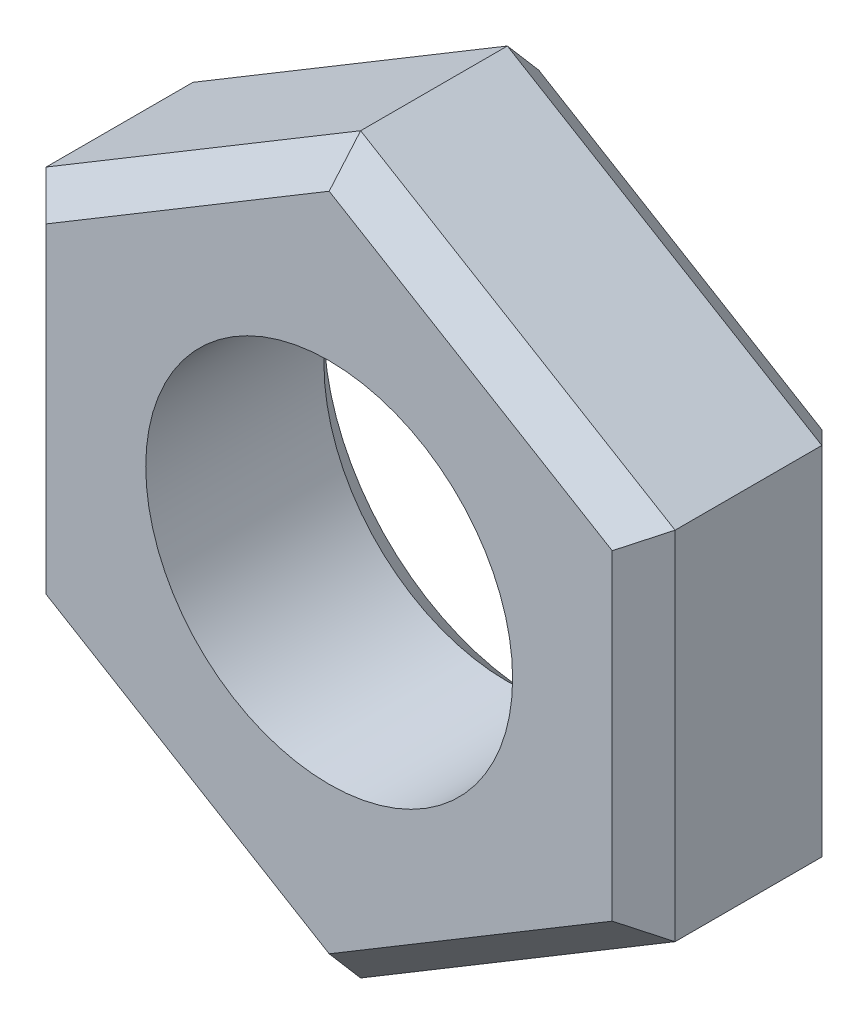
SolidWorks part; units mm, degrees
ref_plane "Plan de face" through (0, 0, 0) normal (0, 0, 1) x (1, 0, 0)
ref_plane "Plan de dessus" through (0, 0, 0) normal (0, 1, 0) x (1, 0, 0)
ref_plane "Plan de droite" through (0, 0, 0) normal (1, 0, 0) x (0, 0, -1)
sketch "Esquisse1" plane through (0, 0, 0) normal (0, 0, 1) x (1, 0, 0)
  line L0 (0, 17.5) -> (0, 0) construction
  line L1 (0, 0) -> (-15, 0) construction
  line L2 (-15, -8.5) -> (-15, 8.5)
  line L3 (-15, 8.5) -> (0, 17.5)
  line L4 (15, 8.5) -> (0, 17.5)
  line L5 (15, -8.5) -> (15, 8.5)
  line L6 (-15, -8.5) -> (0, -17.5)
  line L7 (15, -8.5) -> (0, -17.5)
  circle A0 centre (0, 0) radius 8.75
  point P10 (15, 0)
  dimension "D4" = 17.5
  dimension "D1" = 30
  dimension "D2" = 35
  dimension "D3" = 17
extrude "Extrusion1" add sketch "Esquisse1" along normal blind 10
chamfer "Chanfrein1" distance 1.5 angle 45 13 edges at (15, 0, 10) (7.5, -13, 10) (-7.5, -13, 10) (-15, 0, 10) (-7.5, 13, 10) (7.5, 13, 10) (8.75, 0, 0) (-7.5, 13, 0) (-15, 0, 0) (-7.5, -13, 0) (7.5, -13, 0) (15, 0, 0) (7.5, 13, 0)
